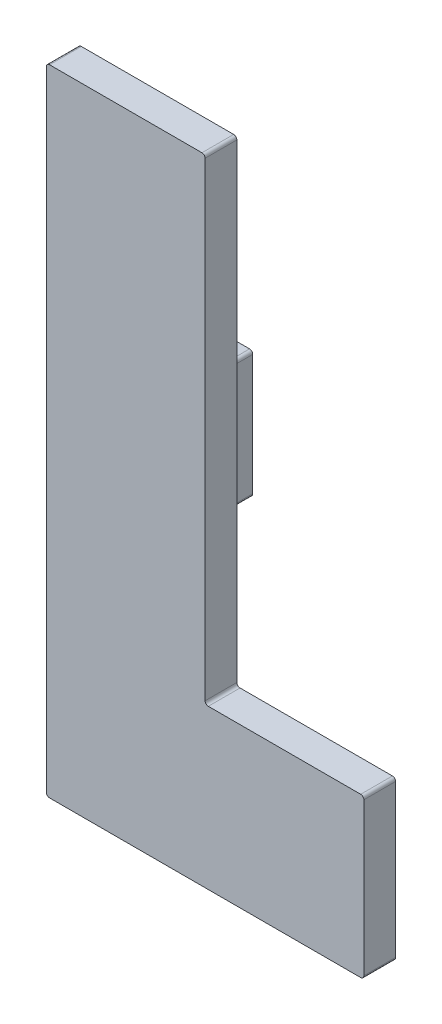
SolidWorks part; units mm, degrees
ref_plane "Ebene vorne" through (0, 0, 0) normal (0, 0, 1) x (1, 0, 0)
ref_plane "Ebene oben" through (0, 0, 0) normal (0, 1, 0) x (1, 0, 0)
ref_plane "Ebene rechts" through (0, 0, 0) normal (1, 0, 0) x (0, 0, -1)
sketch "Skizze1" plane through (0, 0, 0) normal (0, 0, 1) x (1, 0, 0)
  line L0 (0, 0) -> (50, 0)
  line L1 (50, 0) -> (50, 25)
  line L2 (50, 25) -> (25, 25)
  line L3 (25, 25) -> (25, 100)
  line L4 (25, 100) -> (0, 100)
  line L5 (0, 100) -> (0, 0)
  dimension "D1" = 50
  dimension "D2" = 25
  dimension "D3" = 100
extrude "Aufsatz-Linear austragen1" add sketch "Skizze1" along normal blind 5
ref_plane "Ebene1" through (0, 0, 2.5) normal (0, 0, -1) x (-1, 0, 0)
sketch "Skizze3" plane through (0, 0, 5) normal (0, 0, -1) x (-1, 0, 0)
  line L3 (-25, 100) -> (0, 100) construction
  circle A0 centre (-12.5, 87.5) radius 2.7
  point P5 (-12.5, 100)
  dimension "D1" = 5.4
  dimension "12,5" = 12.5
extrude "Schnitt-Linear austragen1" cut sketch "Skizze3" along normal blind 2.9 from offset 0.8
fillet "Verrundung1" radius 0.5 6 edges at (25, 25, 2.5) (50, 25, 2.5) (50, 0, 2.5) (0, 0, 2.5) (0, 100, 2.5) (25, 100, 2.5)
sketch "Skizze4" plane through (0, 0, 0) normal (0, 0, -1) x (-1, 0, 0)
  line L0 (-24.5, 100) -> (-0.5, 100) construction
  line L1 (-15.5, 60) -> (-9.5, 60)
  line L2 (-15.5, 60) -> (-15.5, 40)
  line L3 (-15.5, 40) -> (-9.5, 40)
  line L4 (-9.5, 60) -> (-9.5, 40)
  line L5 (0, 99.5) -> (0, 0.5) construction
  point P6 (-12.5, 100)
  point P7 (-12.5, 60)
  point P10 (0, 50)
  point P11 (-9.5, 50)
  dimension "D1" = 6
  dimension "D2" = 20
extrude "Aufsatz-Linear austragen2" add sketch "Skizze4" along normal blind 12
fillet "Verrundung2" radius 1.5 4 edges at (12.5, 60, 0) (9.5, 50, 0) (12.5, 40, 0) (15.5, 50, 0)
fillet "Verrundung3" radius 0.5 8 edges at (9.0607, 39.5607, -0.4393) (15.9393, 39.5607, -0.4393) (15.9393, 60.4393, -0.4393) (9.0607, 60.4393, -0.4393) (9.5, 40, -6.75) (15.5, 40, -6.75) (15.5, 60, -6.75) (9.5, 60, -6.75)
